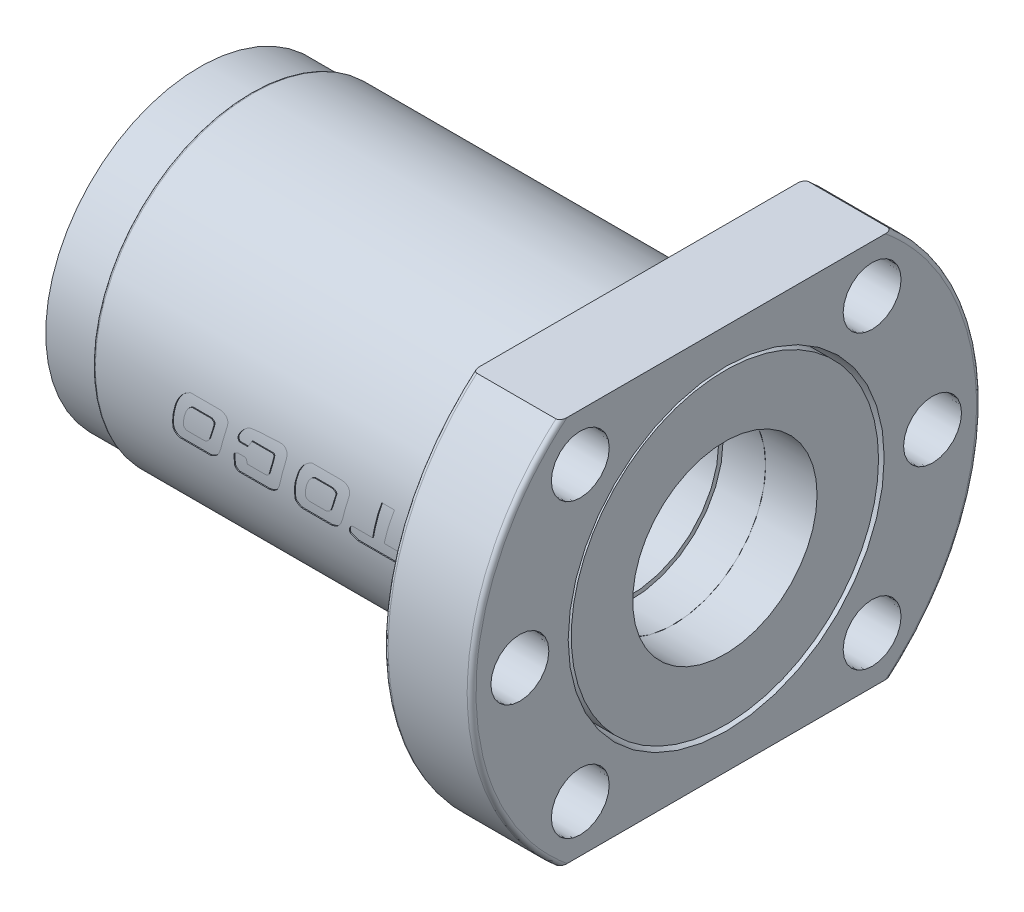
SolidWorks part; units mm, degrees
other "____3[1]"
other "____1[2]"
other "____1[1]"
ref_plane "Front Plane" through (0, 0, 0) normal (0, 0, 1) x (1, 0, 0)
ref_plane "Top Plane" through (0, 0, 0) normal (0, 1, 0) x (1, 0, 0)
ref_plane "Right Plane" through (0, 0, 0) normal (1, 0, 0) x (0, 0, -1)
imported_body "Imported1"
imported_body "Imported2"
imported_body "Imported3"
sketch "Sketch1" plane through (-100.15, 0, 0) normal (-1, 0, 0) x (0, 0, 1)
  circle A0 centre (0, 0) radius 10
extrude "Cut-Extrude1" cut sketch "Sketch1" against normal up to surface (100.15 mm away)
